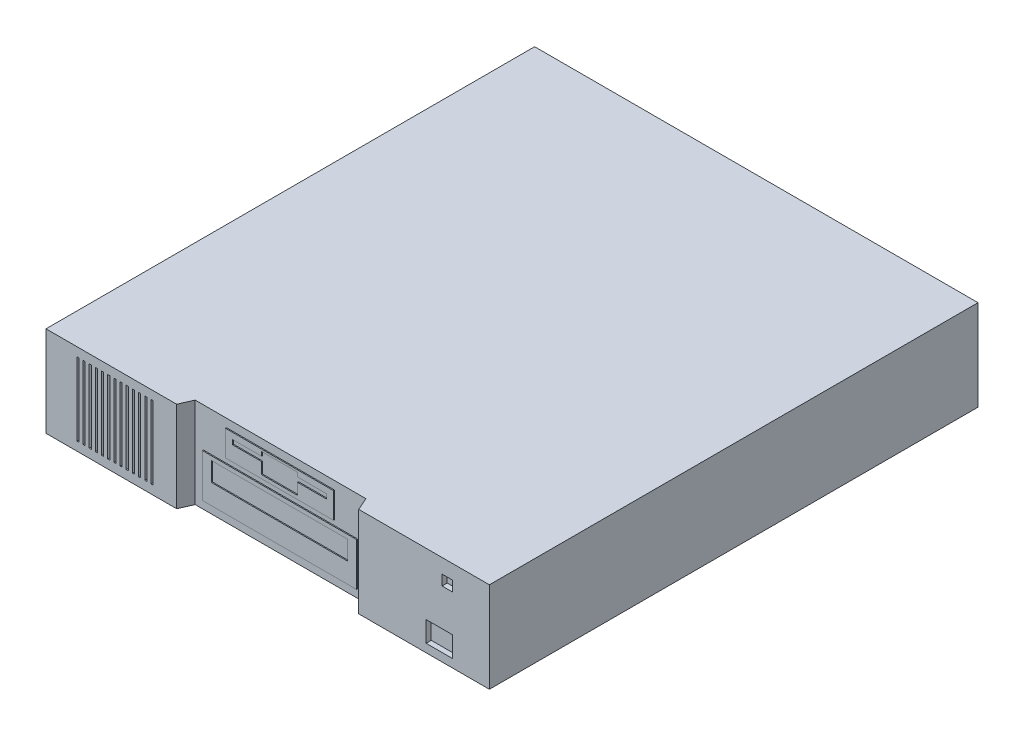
SolidWorks part; units mm, degrees
ref_plane "Plan1" through (0, 0, 0) normal (0, 0, 1) x (1, 0, 0)
ref_plane "Plan2" through (0, 0, 0) normal (0, 1, 0) x (1, 0, 0)
ref_plane "Plan3" through (0, 0, 0) normal (1, 0, 0) x (0, 0, -1)
sketch "Esquisse1" plane through (0, 0, 0) normal (0, 1, 0) x (1, 0, 0)
  line L0 (-28.6856, 0) -> (28.6856, 0) construction
  line L1 (-215.5, 237.5) -> (215.5, 237.5)
  line L2 (-215.5, 237.5) -> (-215.5, -237.5)
  line L3 (-215.5, -237.5) -> (-88.5, -237.5)
  line L4 (215.5, 237.5) -> (215.5, -237.5)
  line L5 (0, 22.7828) -> (0, -22.7828) construction
  line L6 (-88.5, -237.5) -> (-83, -225)
  line L7 (88.5, -237.5) -> (83, -225)
  line L8 (-83, -225) -> (83, -225)
  line L9 (88.5, -237.5) -> (215.5, -237.5)
  dimension "D1" = 431
  dimension "D2" = 475
  dimension "D3" = 177
  dimension "D4" = 166
  dimension "D5" = 12.5
extrude "Base-Extrusion" add sketch "Esquisse1" along normal mid plane 88
sketch "Esquisse2" plane through (0, 0, 225) normal (0, 0, 1) x (1, 0, 0)
  line L0 (0, 50.7644) -> (0, -50.7644) construction
  line L1 (-52.5, 36) -> (52.5, 36)
  line L2 (-52.5, 36) -> (-52.5, 11)
  line L3 (-52.5, 11) -> (52.5, 11)
  line L4 (52.5, 36) -> (52.5, 11)
  line L5 (-83, 44) -> (83, 44) construction
  line L6 (-75, 6) -> (75, 6)
  line L7 (-75, 6) -> (-75, -36)
  line L8 (-75, -36) -> (75, -36)
  line L9 (75, 6) -> (75, -36)
  line L10 (-83, -44) -> (83, -44) construction
  dimension "D1" = 8
  dimension "D2" = 25
  dimension "D3" = 105
  dimension "D4" = 8
  dimension "D5" = 42
  dimension "D6" = 150
extrude "Boss.-Extru.1" add sketch "Esquisse2" along normal blind 1
sketch "Esquisse3" plane through (0, 0, 226) normal (0, 0, 1) x (1, 0, 0)
  line L0 (0, 48.6344) -> (0, -48.6344) construction
  line L1 (-66, 2) -> (66, 2)
  line L2 (-66, 2) -> (-66, -16.5)
  line L3 (-66, -16.5) -> (66, -16.5)
  line L4 (66, 2) -> (66, -16.5)
  line L5 (-45.5, 30) -> (-17.5, 30)
  line L6 (-45.5, 30) -> (-45.5, 25.5)
  line L7 (-45.5, 25.5) -> (-17.5, 25.5)
  line L8 (45.5, 30) -> (45.5, 25.5)
  line L9 (-17.5, 34) -> (17.5, 34)
  line L10 (-17.5, 34) -> (-17.5, 30)
  line L11 (-17.5, 14.5) -> (17.5, 14.5)
  line L12 (17.5, 34) -> (17.5, 30)
  line L13 (-17.5, 25.5) -> (-17.5, 14.5)
  line L14 (17.5, 30) -> (45.5, 30)
  line L15 (17.5, 25.5) -> (17.5, 14.5)
  line L16 (17.5, 25.5) -> (45.5, 25.5)
  line L18 (52.5, 36) -> (-52.5, 36) construction
  line L19 (75, 6) -> (-75, 6) construction
  dimension "D1" = 91
  dimension "D2" = 4.5
  dimension "D3" = 35
  dimension "D4" = 11
  dimension "D5" = 4
  dimension "D6" = 2
  dimension "D7" = 132
  dimension "D8" = 4
  dimension "D9" = 18.5
extrude "Enlèv. mat.-Extru.2" cut sketch "Esquisse3" against normal up to surface (1 mm away)
sketch "Esquisse4" plane through (0, 0, 237.5) normal (0, 0, 1) x (1, 0, 0)
  line L0 (-88.5, 44) -> (-88.5, -44) construction
  line L1 (-113.5, 35.5) -> (-111.5, 35.5)
  line L2 (-113.5, 35.5) -> (-113.5, -35.5)
  line L3 (-113.5, -35.5) -> (-111.5, -35.5)
  line L4 (-111.5, 35.5) -> (-111.5, -35.5)
  line L5 (-27.8671, 0) -> (27.8671, 0) construction
  dimension "D1" = 23
  dimension "D2" = 2
  dimension "D3" = 71
extrude "Enlèv. mat.-Extru.3" cut sketch "Esquisse4" against normal blind 3
pattern_linear "Répétition linéaire1" count 13 spacing 6
sketch "Esquisse5" plane through (0, 0, 237.5) normal (0, 0, 1) x (1, 0, 0)
  line L0 (215.5, 44) -> (215.5, -44) construction
  line L1 (169.5, 30) -> (179.5, 30)
  line L2 (169.5, 30) -> (169.5, 20)
  line L3 (169.5, 20) -> (179.5, 20)
  line L4 (179.5, 30) -> (179.5, 20)
  line L5 (154, -16) -> (179.5, -16)
  line L6 (154, -16) -> (154, -36)
  line L7 (154, -36) -> (179.5, -36)
  line L8 (179.5, -16) -> (179.5, -36)
  line L9 (88.5, -44) -> (215.5, -44) construction
  line L10 (88.5, 44) -> (215.5, 44) construction
  dimension "D1" = 36
  dimension "D2" = 25.5
  dimension "D3" = 20
  dimension "D4" = 8
  dimension "D5" = 10
  dimension "D6" = 14
extrude "Enlèv. mat.-Extru.4" cut sketch "Esquisse5" against normal blind 5
